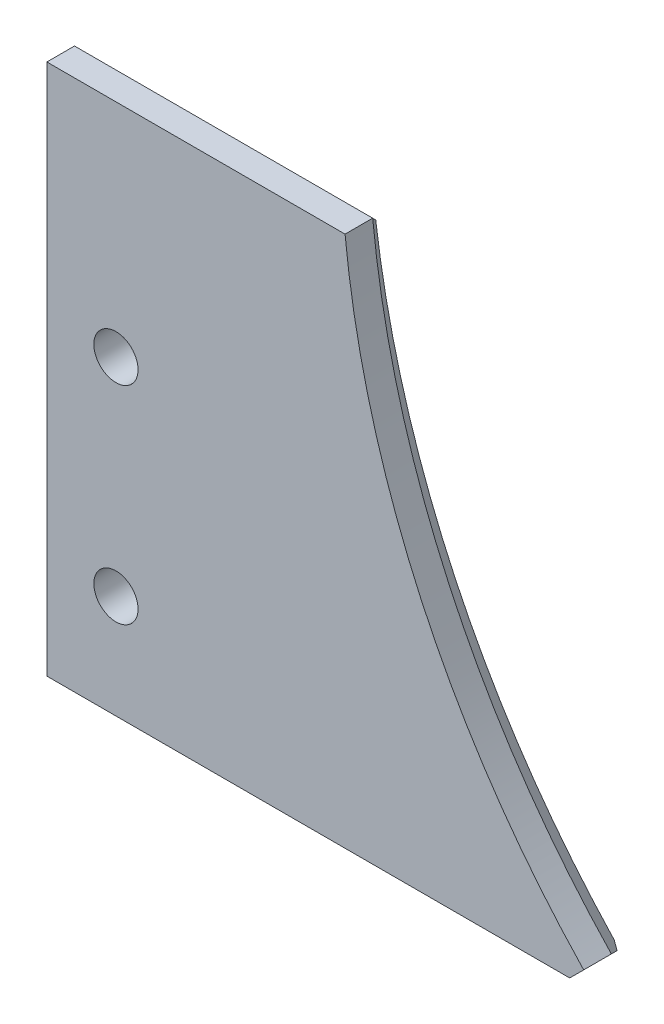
SolidWorks part; units mm, degrees
ref_plane "前视基准面" through (0, 0, 0) normal (0, 0, 1) x (1, 0, 0)
ref_plane "上视基准面" through (0, 0, 0) normal (0, 1, 0) x (1, 0, 0)
ref_plane "右视基准面" through (0, 0, 0) normal (1, 0, 0) x (0, 0, -1)
sketch "草图1" plane through (0, 0, 0) normal (0, 0, 1) x (1, 0, 0)
  line L0 (-85, -6) -> (-63.467, -6)
  line L2 (-85, -6) -> (-85, -45)
  line L5 (-85, -45) -> (-45.156, -45)
  circle A0 centre (0, 0) radius 63.75
  arc A1 (-63.467, -6) -> (-45.156, -45) centre (0, 0) ccw
  dimension "D1" = 127.5
  dimension "D2" = 39
  dimension "D3" = 85
  dimension "D4" = 6
extrude "凸台-拉伸1" add sketch "草图1" along normal blind 4 contours A0 L0 L2 L5
sketch "草图2" plane through (0, 0, 4) normal (0, 0, 1) x (1, 0, 0)
  line L0 (-46.2135, -45) -> (-46.2135, -43.9132)
  line L2 (-85, -45) -> (-45.156, -45) construction
  line L3 (-46.2135, -43.9132) -> (-45.156, -45)
  line L4 (-45.156, -45) -> (-46.2135, -45)
  arc A1 (-63.467, -6) -> (-45.156, -45) centre (0, 0) ccw construction
sketch "草图3" plane through (-85, 0, 0) normal (-1, 0, 0) x (0, 0, 1)
  line L0 (0, -6.5) -> (4, -6.5)
  line L1 (0, -6) -> (0, -45) construction
  line L2 (4, -6) -> (4, -45) construction
  line L3 (4, -6.5) -> (4, -6)
  line L4 (4, -6) -> (0, -6)
  line L5 (0, -6) -> (0, -6.5)
  dimension "D1" = 0.5
extrude "切除-拉伸2" cut sketch "草图3" against normal through all
sketch "草图5" plane through (0, 0, 4) normal (0, 0, 1) x (1, 0, 0)
  line L0 (-85, -45) -> (-45.156, -45) construction
  line L1 (-85, -6.5) -> (-85, -45) construction
  circle A0 centre (-80, -37.5) radius 1.6
  circle A1 centre (-80, -22.5) radius 1.6
  dimension "D2" = 15
  dimension "D3" = 3.2
  dimension "D1" = 7.5
  dimension "D4" = 5
extrude "切除-拉伸4" cut sketch "草图5" against normal blind 4
chamfer "倒角2" distance 2 angle 45 3 edges at (-57.5988, -27.321, 0) (-74.2089, -6.5, 0) (-45.156, -45, 2)
